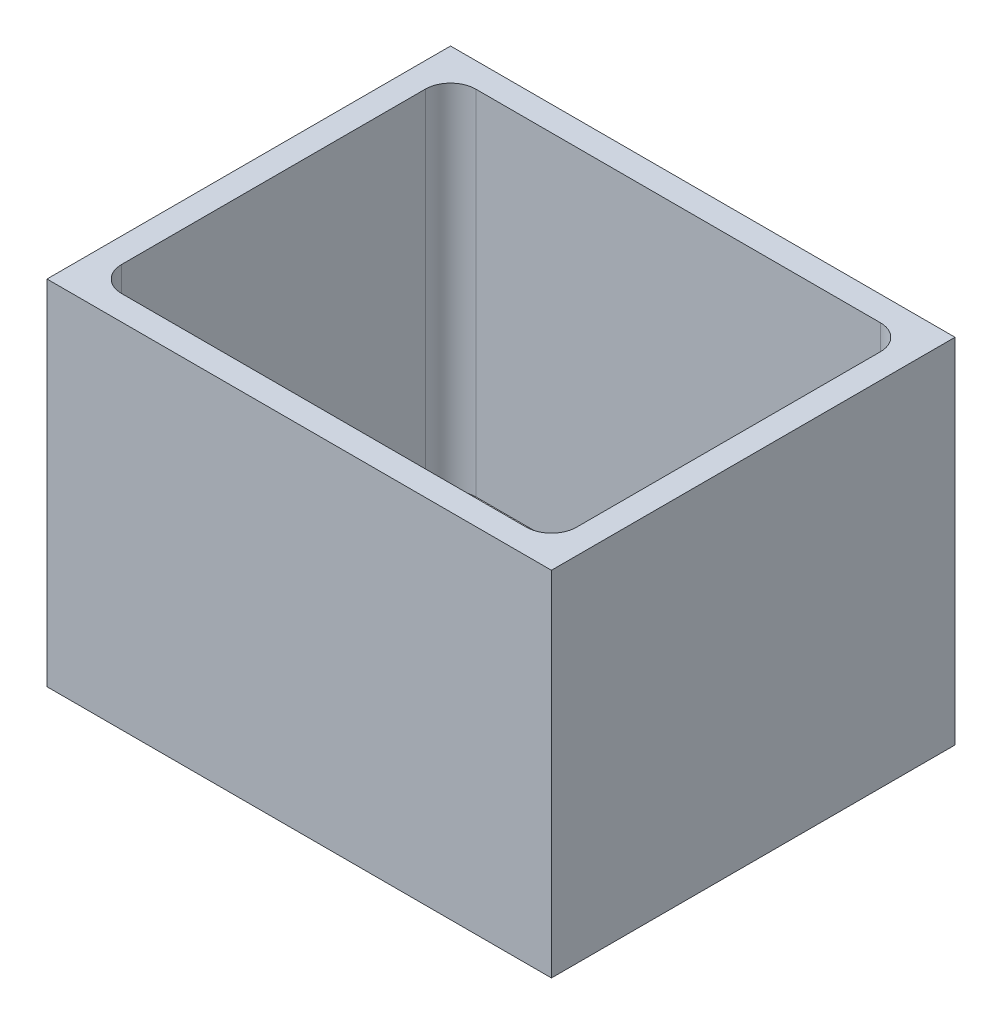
SolidWorks part; units mm, degrees
ref_plane "Front Plane" through (0, 0, 0) normal (0, 0, 1) x (1, 0, 0)
ref_plane "Top Plane" through (0, 0, 0) normal (0, 1, 0) x (1, 0, 0)
ref_plane "Right Plane" through (0, 0, 0) normal (1, 0, 0) x (0, 0, -1)
sketch "Sketch1" plane through (0, 0, 0) normal (0, 1, 0) x (1, 0, 0)
  line L1 (-76.2962, 34.5933) -> (50.7038, 34.5933)
  line L2 (-76.2962, 34.5933) -> (-76.2962, -67.0067)
  line L3 (-76.2962, -67.0067) -> (50.7038, -67.0067)
  line L4 (50.7038, 34.5933) -> (50.7038, -67.0067)
  dimension "D1" = 127
  dimension "D2" = 101.6
extrude "Boss-Extrude1" add sketch "Sketch1" along normal blind 88.9
sketch "Sketch2" plane through (0, 88.9, 0) normal (0, 1, 0) x (1, 0, 0)
  line L0 (50.7038, 34.5933) -> (-76.2962, 34.5933) construction
  line L1 (-70.0732, 28.3703) -> (44.4808, 28.3703)
  line L2 (-70.0732, 28.3703) -> (-70.0732, -60.7837)
  line L3 (-70.0732, -60.7837) -> (44.4808, -60.7837)
  line L4 (44.4808, 28.3703) -> (44.4808, -60.7837)
  line L5 (50.7038, -67.0067) -> (50.7038, 34.5933) construction
  line L7 (-76.2962, 34.5933) -> (-76.2962, -67.0067) construction
  circle A0 centre (-63.7232, 22.0203) radius 6.35
  circle A1 centre (38.1308, 22.0203) radius 6.35
  circle A2 centre (-63.7232, -54.4337) radius 6.35
  circle A3 centre (38.1308, -54.4337) radius 6.35
  dimension "D5" = 6.35
  dimension "D1" = 89.154
  dimension "D2" = 114.554
  dimension "D3" = 6.223
  dimension "D4" = 6.223
  dimension "D6" = 6.35
  dimension "D7" = 6.35
  dimension "D8" = 6.35
  dimension "D9" = 6.35
  dimension "D10" = 6.35
  dimension "D11" = 6.35
  dimension "D12" = 6.35
  dimension "D13" = 12.573
extrude "Cut-Extrude1" cut sketch "Sketch2" against normal through all contours A3 L4 A1 L1 A0 L2 A2 L3 | A0 | A1 | A3 | A2
